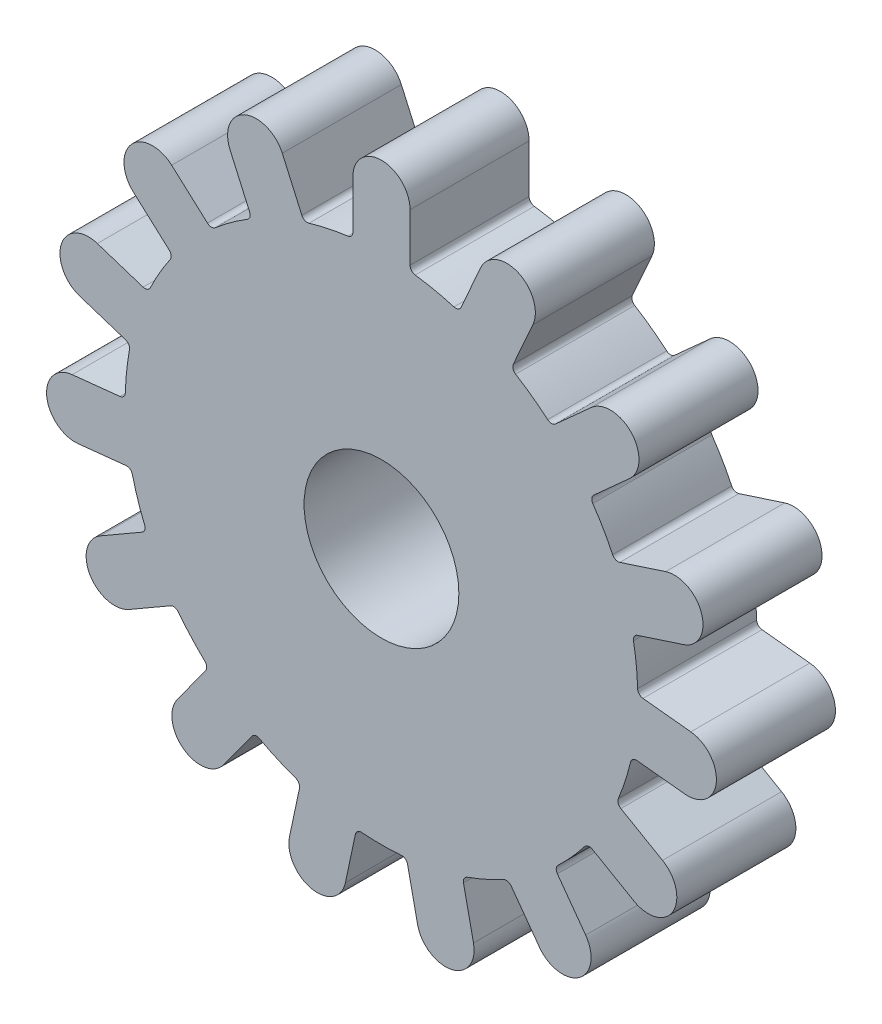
SolidWorks part; units mm, degrees
ref_plane "Front Plane" through (0, 0, 0) normal (0, 0, 1) x (1, 0, 0)
ref_plane "Top Plane" through (0, 0, 0) normal (0, 1, 0) x (1, 0, 0)
ref_plane "Right Plane" through (0, 0, 0) normal (1, 0, 0) x (0, 0, -1)
sketch "Sketch1" plane through (0, 0, 0) normal (0, 0, 1) x (1, 0, 0)
  line L1 (-2.4, 25.875) -> (-2.4, 21.8332)
  line L2 (2.4, 25.875) -> (2.4, 21.8332)
  line L3 (8.3318, 24.6142) -> (6.6879, 20.9218)
  line L4 (12.7168, 22.6618) -> (11.0729, 18.9695)
  line L5 (17.623, 19.0973) -> (14.6194, 16.3928)
  line L6 (20.8348, 15.5302) -> (17.8312, 12.8257)
  line L7 (23.8669, 10.2784) -> (20.023, 9.0294)
  line L8 (25.3502, 5.7133) -> (21.5063, 4.4643)
  line L9 (25.9841, -0.3178) -> (21.9645, 0.1047)
  line L10 (25.4824, -5.0915) -> (21.4628, -4.669)
  line L11 (23.6084, -10.859) -> (20.1081, -8.8382)
  line L12 (21.2084, -15.016) -> (17.7081, -12.9951)
  line L13 (17.1506, -19.5226) -> (14.7749, -16.2528)
  line L14 (13.2673, -22.344) -> (10.8916, -19.0742)
  line L15 (7.7273, -24.8106) -> (6.8869, -20.8571)
  line L16 (3.0322, -25.8086) -> (2.1918, -21.8551)
  line L17 (-3.0322, -25.8086) -> (-2.1918, -21.8551)
  line L18 (-7.7273, -24.8106) -> (-6.8869, -20.8571)
  line L19 (-13.2673, -22.344) -> (-10.8916, -19.0742)
  line L20 (-17.1506, -19.5226) -> (-14.7749, -16.2528)
  line L21 (-21.2084, -15.016) -> (-17.7081, -12.9951)
  line L22 (-23.6084, -10.859) -> (-20.1081, -8.8382)
  line L23 (-25.4824, -5.0915) -> (-21.4628, -4.669)
  line L24 (-25.9841, -0.3178) -> (-21.9645, 0.1047)
  line L25 (-25.3502, 5.7133) -> (-21.5063, 4.4643)
  line L26 (-23.8669, 10.2784) -> (-20.023, 9.0294)
  line L27 (-20.8348, 15.5302) -> (-17.8312, 12.8257)
  line L28 (-17.623, 19.0973) -> (-14.6194, 16.3928)
  line L29 (-12.7168, 22.6618) -> (-11.0729, 18.9695)
  line L30 (-8.3318, 24.6142) -> (-6.6879, 20.9218)
  arc A0 (-11.2679, 18.3401) -> (-13.9605, 16.3838) centre (0, 0) ccw
  arc A1 (-2.8342, 21.3376) -> (-6.0896, 20.6456) centre (0, 0) ccw
  arc A2 (2.4, 25.875) -> (-2.4, 25.875) centre (0, 25.875) ccw
  arc A3 (2.4, 21.8332) -> (2.8342, 21.3376) centre (2.9, 21.8332) ccw
  arc A4 (-2.4, 21.8332) -> (-2.8342, 21.3376) centre (-2.9, 21.8332) cw
  arc A5 (12.7168, 22.6618) -> (8.3318, 24.6142) centre (10.5243, 23.638) ccw
  arc A6 (6.6879, 20.9218) -> (6.0896, 20.6456) centre (6.2311, 21.1252) cw
  arc A7 (11.0729, 18.9695) -> (11.2679, 18.3401) centre (11.5297, 18.7661) ccw
  arc A8 (20.8348, 15.5302) -> (17.623, 19.0973) centre (19.2289, 17.3138) ccw
  arc A9 (14.6194, 16.3928) -> (13.9605, 16.3838) centre (14.2848, 16.7644) cw
  arc A10 (17.8312, 12.8257) -> (17.7534, 12.1714) centre (18.1657, 12.4542) ccw
  arc A11 (25.3502, 5.7133) -> (23.8669, 10.2784) centre (24.6086, 7.9958) ccw
  arc A12 (20.023, 9.0294) -> (19.4175, 9.2891) centre (19.8685, 9.5049) cw
  arc A13 (21.5063, 4.4643) -> (21.1691, 3.8982) centre (21.6608, 3.9888) ccw
  arc A14 (25.4824, -5.0915) -> (25.9841, -0.3178) centre (25.7333, -2.7047) ccw
  arc A15 (21.9645, 0.1047) -> (21.517, 0.5883) centre (22.0168, 0.6019) cw
  arc A16 (21.4628, -4.669) -> (20.9245, -5.049) centre (21.4105, -5.1663) ccw
  arc A17 (21.2084, -15.016) -> (23.6084, -10.859) centre (22.4084, -12.9375) ccw
  arc A18 (20.1081, -8.8382) -> (19.896, -8.2143) centre (20.3581, -8.4051) cw
  arc A19 (17.7081, -12.9951) -> (17.0618, -13.1233) centre (17.4581, -13.4281) ccw
  arc A20 (13.2673, -22.344) -> (17.1506, -19.5226) centre (15.2089, -20.9333) ccw
  arc A21 (14.7749, -16.2528) -> (14.8348, -15.5966) centre (15.1794, -15.9589) cw
  arc A22 (10.8916, -19.0742) -> (10.249, -18.9284) centre (10.4871, -19.368) ccw
  arc A23 (3.0322, -25.8086) -> (7.7273, -24.8106) centre (5.3797, -25.3096) ccw
  arc A24 (6.8869, -20.8571) -> (7.2086, -20.2821) centre (7.376, -20.7532) cw
  arc A25 (2.1918, -21.8551) -> (1.6641, -21.4606) centre (1.7028, -21.9591) ccw
  arc A26 (-7.7273, -24.8106) -> (-3.0322, -25.8086) centre (-5.3797, -25.3096) ccw
  arc A27 (-2.1918, -21.8551) -> (-1.6641, -21.4606) centre (-1.7028, -21.9591) cw
  arc A28 (-6.8869, -20.8571) -> (-7.2086, -20.2821) centre (-7.376, -20.7532) ccw
  arc A29 (-17.1506, -19.5226) -> (-13.2673, -22.344) centre (-15.2089, -20.9333) ccw
  arc A30 (-10.8916, -19.0742) -> (-10.249, -18.9284) centre (-10.4871, -19.368) cw
  arc A31 (-14.7749, -16.2528) -> (-14.8348, -15.5966) centre (-15.1794, -15.9589) ccw
  arc A32 (-23.6084, -10.859) -> (-21.2084, -15.016) centre (-22.4084, -12.9375) ccw
  arc A33 (-17.7081, -12.9951) -> (-17.0618, -13.1233) centre (-17.4581, -13.4281) cw
  arc A34 (-20.1081, -8.8382) -> (-19.896, -8.2143) centre (-20.3581, -8.4051) ccw
  arc A35 (-25.9841, -0.3178) -> (-25.4824, -5.0915) centre (-25.7333, -2.7047) ccw
  arc A36 (-21.4628, -4.669) -> (-20.9245, -5.049) centre (-21.4105, -5.1663) cw
  arc A37 (-21.9645, 0.1047) -> (-21.517, 0.5883) centre (-22.0168, 0.6019) ccw
  arc A38 (-23.8669, 10.2784) -> (-25.3502, 5.7133) centre (-24.6086, 7.9958) ccw
  arc A39 (-21.5063, 4.4643) -> (-21.1691, 3.8982) centre (-21.6608, 3.9888) cw
  arc A40 (-20.023, 9.0294) -> (-19.4175, 9.2891) centre (-19.8685, 9.5049) ccw
  arc A41 (-17.623, 19.0973) -> (-20.8348, 15.5302) centre (-19.2289, 17.3138) ccw
  arc A42 (-17.8312, 12.8257) -> (-17.7534, 12.1714) centre (-18.1657, 12.4542) cw
  arc A43 (-14.6194, 16.3928) -> (-13.9605, 16.3838) centre (-14.2848, 16.7644) ccw
  arc A44 (-8.3318, 24.6142) -> (-12.7168, 22.6618) centre (-10.5243, 23.638) ccw
  arc A45 (-11.0729, 18.9695) -> (-11.2679, 18.3401) centre (-11.5297, 18.7661) cw
  arc A46 (-6.6879, 20.9218) -> (-6.0896, 20.6456) centre (-6.2311, 21.1252) ccw
  arc A47 (-17.7534, 12.1714) -> (-19.4175, 9.2891) centre (0, 0) ccw
  arc A48 (6.0896, 20.6456) -> (2.8342, 21.3376) centre (0, 0) ccw
  arc A49 (13.9605, 16.3838) -> (11.2679, 18.3401) centre (0, 0) ccw
  arc A50 (19.4175, 9.2891) -> (17.7534, 12.1714) centre (0, 0) ccw
  arc A51 (21.517, 0.5883) -> (21.1691, 3.8982) centre (0, 0) ccw
  arc A52 (19.896, -8.2143) -> (20.9245, -5.049) centre (0, 0) ccw
  arc A53 (14.8348, -15.5966) -> (17.0618, -13.1233) centre (0, 0) ccw
  arc A54 (7.2086, -20.2821) -> (10.249, -18.9284) centre (0, 0) ccw
  arc A55 (-1.6641, -21.4606) -> (1.6641, -21.4606) centre (0, 0) ccw
  arc A56 (-10.249, -18.9284) -> (-7.2086, -20.2821) centre (0, 0) ccw
  arc A57 (-17.0618, -13.1233) -> (-14.8348, -15.5966) centre (0, 0) ccw
  arc A58 (-20.9245, -5.049) -> (-19.896, -8.2143) centre (0, 0) ccw
  arc A59 (-21.1691, 3.8982) -> (-21.517, 0.5883) centre (0, 0) ccw
  circle A60 centre (0, 0) radius 6.5
  point P143 (0, 0)
  dimension "D1" = 13
  dimension "D2" = 43.05
  dimension "D3" = 4.8
  dimension "D4" = 0.5
  dimension "D5" = 15
extrude "Boss-Extrude1" add sketch "Sketch1" along normal blind 10
